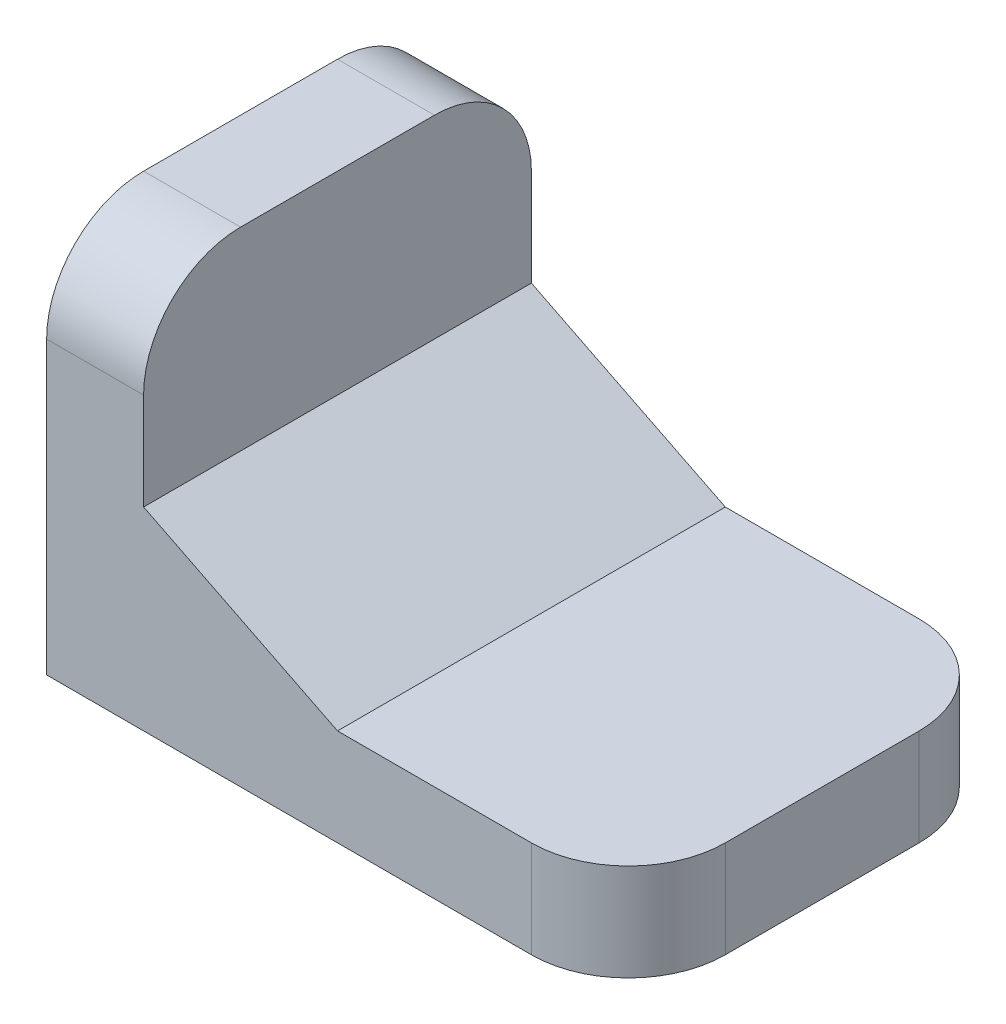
SolidWorks part; units mm, degrees
ref_plane "Front Plane" through (0, 0, 0) normal (0, 0, 1) x (1, 0, 0)
ref_plane "Top Plane" through (0, 0, 0) normal (0, 1, 0) x (1, 0, 0)
ref_plane "Right Plane" through (0, 0, 0) normal (1, 0, 0) x (0, 0, -1)
sketch "Sketch1" plane through (0, 0, 0) normal (0, 0, 1) x (1, 0, 0)
  line L0 (0, 0) -> (0, 40)
  line L1 (0, 40) -> (10, 40)
  line L2 (10, 40) -> (10, 20)
  line L3 (10, 20) -> (30, 10)
  line L4 (30, 10) -> (60, 10)
  line L5 (60, 10) -> (60, 0)
  line L6 (60, 0) -> (0, 0)
  dimension "D1" = 10
  dimension "D2" = 40
  dimension "D3" = 60
  dimension "D4" = 30
  dimension "D5" = 10
  dimension "D6" = 10
extrude "Extrude1" add sketch "Sketch1" along normal mid plane 40
fillet "Fillet1" radius 10 4 edges at (60, 5, -20) (60, 5, 20) (5, 40, -20) (5, 40, 20)
